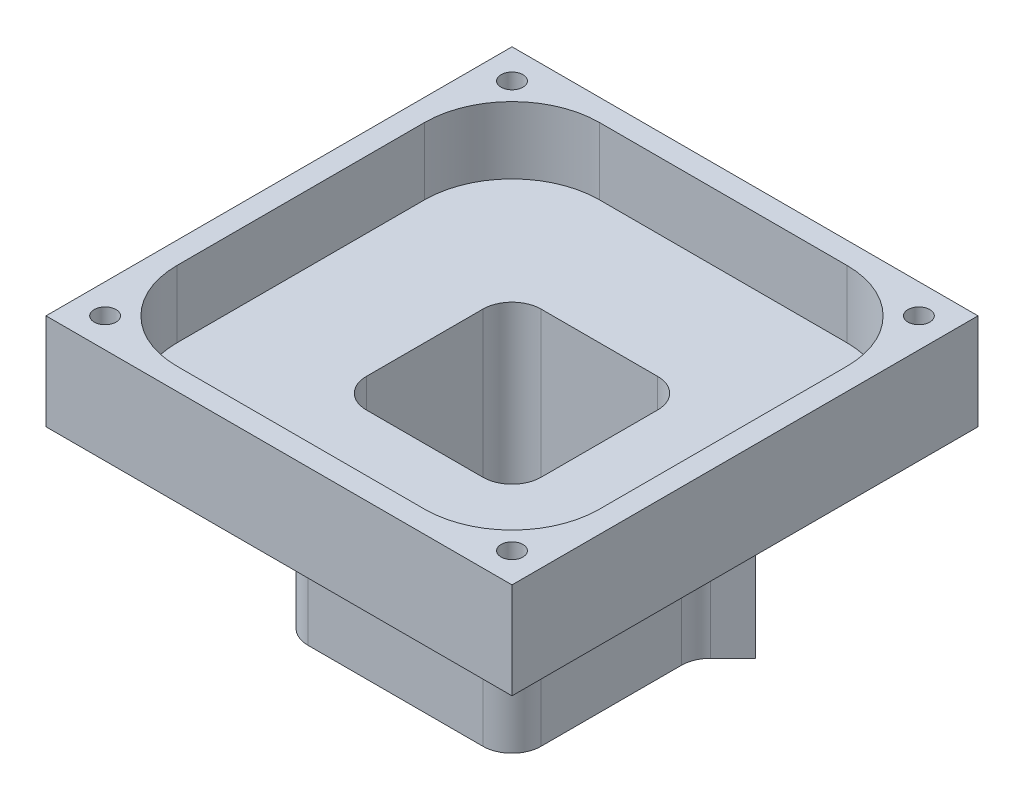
SolidWorks part; units mm, degrees
ref_plane "Front Plane" through (0, 0, 0) normal (0, 0, 1) x (1, 0, 0)
ref_plane "Top Plane" through (0, 0, 0) normal (0, 1, 0) x (1, 0, 0)
ref_plane "Right Plane" through (0, 0, 0) normal (1, 0, 0) x (0, 0, -1)
sketch "Sketch1" plane through (0, 0, 0) normal (0, 1, 0) x (1, 0, 0)
  line L1 (-4, 4) -> (4, 4)
  line L2 (-4, 4) -> (-4, -4)
  line L3 (-4, -4) -> (4, -4)
  line L4 (4, 4) -> (4, -4)
  line L5 (-4, 4) -> (4, -4) construction
  line L6 (-4, -4) -> (4, 4) construction
  dimension "D2" = 8
extrude "Boss-Extrude1" add sketch "Sketch1" along normal blind 6
sketch "Sketch2" plane through (0, 6, 0) normal (0, 1, 0) x (1, 0, 0)
  line L1 (8, 8) -> (-8, 8)
  line L2 (8, 8) -> (8, -8)
  line L3 (8, -8) -> (-8, -8)
  line L4 (-8, 8) -> (-8, -8)
  line L5 (8, 8) -> (-8, -8) construction
  line L6 (8, -8) -> (-8, 8) construction
  point P0 (0, 0)
  dimension "D1" = 16
  dimension "D2" = 16
extrude "Boss-Extrude2" add sketch "Sketch2" along normal blind 3.3
sketch "Sketch3" plane through (0, 0, 0) normal (0, -1, 0) x (1, 0, 0)
  line L1 (-3, -3) -> (3, -3)
  line L2 (-3, -3) -> (-3, 3)
  line L3 (-3, 3) -> (3, 3)
  line L4 (3, -3) -> (3, 3)
  line L5 (-3, -3) -> (3, 3) construction
  line L6 (-3, 3) -> (3, -3) construction
  dimension "D2" = 6
extrude "Cut-Extrude1" cut sketch "Sketch3" against normal through all
sketch "Sketch6" plane through (0, 9.3, 0) normal (0, 1, 0) x (1, 0, 0)
  line L1 (7.25, 7.25) -> (-7.25, 7.25)
  line L2 (7.25, 7.25) -> (7.25, -7.25)
  line L3 (7.25, -7.25) -> (-7.25, -7.25)
  line L4 (-7.25, 7.25) -> (-7.25, -7.25)
  line L5 (7.25, 7.25) -> (-7.25, -7.25) construction
  line L6 (7.25, -7.25) -> (-7.25, 7.25) construction
  point P0 (0, 0)
  dimension "D1" = 14.5
  dimension "D2" = 14.5
extrude "Cut-Extrude3" cut sketch "Sketch6" against normal blind 2.3
fillet "Fillet1" radius 3 4 edges at (-7.25, 8.15, -7.25) (7.25, 8.15, -7.25) (7.25, 8.15, 7.25) (-7.25, 8.15, 7.25)
sketch "Sketch11" plane through (0, 9.3, 0) normal (0, 1, 0) x (1, 0, 0)
  line L1 (-6.985, 6.985) -> (6.985, 6.985) construction
  line L2 (-6.985, 6.985) -> (-6.985, -6.985) construction
  line L3 (-6.985, -6.985) -> (6.985, -6.985) construction
  line L4 (6.985, 6.985) -> (6.985, -6.985) construction
  line L5 (-6.985, 6.985) -> (6.985, -6.985) construction
  line L6 (-6.985, -6.985) -> (6.985, 6.985) construction
  circle A0 centre (6.985, -6.985) radius 0.375
  circle A1 centre (6.985, 6.985) radius 0.375
  circle A2 centre (-6.985, 6.985) radius 0.375
  circle A3 centre (-6.985, -6.985) radius 0.375
  point P0 (0, 0)
  dimension "D3" = 0.75
  dimension "D1" = 13.97
  dimension "D2" = 13.97
extrude "Cut-Extrude7" cut sketch "Sketch11" against normal through all
sketch "Sketch12" plane through (0, 0, 0) normal (0, -1, 0) x (1, 0, 0)
  line L0 (5.0607, -3.2929) -> (4, -2.2322)
  line L1 (4, 4) -> (4, -4) construction
  line L2 (4, -2.2322) -> (2.2322, -4)
  line L3 (4, -4) -> (-4, -4) construction
  line L4 (2.2322, -4) -> (3.2929, -5.0607)
  line L5 (3.2929, -5.0607) -> (5.0607, -3.2929)
  dimension "D1" = 45
  dimension "D2" = 2.5
  dimension "D3" = 0.25
extrude "Boss-Extrude3" add sketch "Sketch12" against normal up to next
fillet "Fillet4" radius 1 4 edges at (-3, 3.5, -3) (-3, 3.5, 3) (3, 3.5, 3) (3, 3.5, -3)
fillet "Fillet2" radius 1 2 edges at (4, 3, -2.2322) (2.2322, 3, -4)
sketch "Sketch13" plane through (4.1768, 0, -4.1768) normal (0.7071, 0, -0.7071) x (-0.7071, 0, -0.7071)
  line L0 (0, 0) -> (0, 1.25) construction
  line L1 (1.25, 0) -> (-1.25, 0) construction
  line L2 (0, 1.25) -> (0, 3.25) construction
  dimension "D1" = 1.25
  dimension "D2" = 2
hole_wizard "Tap Drill for #0-80 Tap1" positions "Sketch15" profile "Sketch14" hole size "#0-80" standard "ANSI Inch"
sketch "Sketch15" plane through (4.1768, 0, -4.1768) normal (0.7071, 0, -0.7071) x (-0.7071, 0, -0.7071)
  point P0 (0, 1.25)
  point P3 (0, 3.25)
sketch "Sketch14" plane through (4.1768, 1.25, -4.1768) normal (0, 1, 0) x (-0.7071, 0, -0.7071)
  line L0 (0, 0) -> (0, 7.4679)
  line L1 (0, 7.4679) -> (0.5956, 7.11)
  line L2 (0.5956, 7.11) -> (0.5956, 0)
  line L5 (0.5956, 0) -> (0, 0)
  line L10 (0, 7.4679) -> (-0.5956, 7.11) construction
  line L11 (0, -6.35) -> (0, 107.95) construction
  dimension "Hole Dia." = 1.1913
  dimension "Hole Depth" = 7.11
  dimension "Drill Angle" = 118
fillet "Fillet5" radius 1 3 edges at (4, 3, 4) (-4, 3, 4) (-4, 3, -4)
